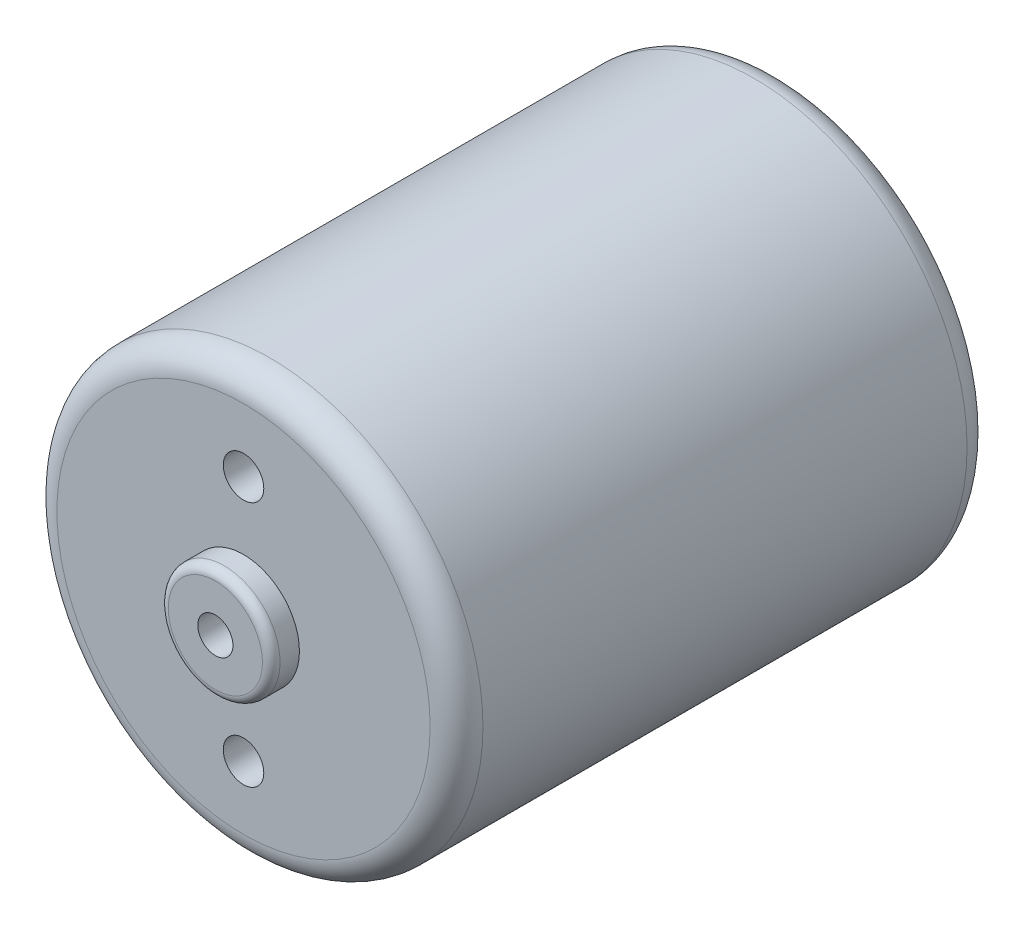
SolidWorks part; units mm, degrees
ref_plane "Front Plane" through (0, 0, 0) normal (0, 0, 1) x (1, 0, 0)
ref_plane "Top Plane" through (0, 0, 0) normal (0, 1, 0) x (1, 0, 0)
ref_plane "Right Plane" through (0, 0, 0) normal (1, 0, 0) x (0, 0, -1)
sketch "Sketch1" plane through (0, 0, 0) normal (0, 0, 1) x (1, 0, 0)
  circle A0 centre (0, 0) radius 12.1
  dimension "D1" = 24.2
extrude "Boss-Extrude1" add sketch "Sketch1" along normal mid plane 30.5
fillet "Fillet1" radius 1.5 2 edges at (12.1, 0, -15.25) (12.1, 0, 15.25)
sketch "Sketch2" plane through (0, 0, 15.25) normal (0, 0, 1) x (1, 0, 0)
  circle A0 centre (0, 0) radius 3.175
  dimension "D1" = 6.35
extrude "Boss-Extrude2" add sketch "Sketch2" along normal blind 1.6
sketch "Sketch5" plane through (0, 0, -15.25) normal (0, 0, -1) x (-1, 0, 0)
  line L0 (3.75, 2) -> (3.75, -2)
  line L1 (-4.25, -0.8446) -> (-4.25, 6.6258) construction
  line L2 (-12.7566, 0) -> (12.7566, 0) construction
  line L3 (13.31, 0) -> (-13.31, 0) construction
  line L4 (0, 7.7658) -> (0, -6.5085) construction
  line L5 (0, 13.31) -> (0, -13.31) construction
  arc A0 (3.75, 2) -> (3.75, -2) centre (0, 0) ccw
  point P12 (0, 0)
  dimension "D1" = 8.5
  dimension "D2" = 8
extrude "Boss-Extrude3" add sketch "Sketch5" along normal blind 2
sketch "Sketch3" plane through (0, 0, 16.85) normal (0, 0, 1) x (1, 0, 0)
  circle A0 centre (0, 0) radius 1
  dimension "D1" = 2
extrude "Cut-Extrude1" cut sketch "Sketch3" against normal through all
sketch "Sketch4" plane through (0, 0, -15.25) normal (0, 0, -1) x (-1, 0, 0)
  line L1 (6.45, -6.45) -> (-6.45, -6.45) construction
  line L2 (6.45, -6.45) -> (6.45, 6.45) construction
  line L3 (6.45, 6.45) -> (-6.45, 6.45) construction
  line L4 (-6.45, -6.45) -> (-6.45, 6.45) construction
  line L5 (6.45, -6.45) -> (-6.45, 6.45) construction
  line L6 (6.45, 6.45) -> (-6.45, -6.45) construction
  circle A0 centre (-6.45, 0) radius 1
  circle A1 centre (6.45, 0) radius 1
  point P0 (0, 0)
  dimension "D2" = 2
  dimension "D1" = 12.9
extrude "Cut-Extrude2" cut sketch "Sketch4" against normal blind 10
sketch "Sketch6" plane through (0, 0, 15.25) normal (0, 0, 1) x (1, 0, 0)
  line L0 (0, -13.31) -> (0, 13.31) construction
  line L1 (-12.9437, 0) -> (13.2761, 0) construction
  line L2 (13.31, 0) -> (-13.31, 0) construction
  circle A0 centre (0, 7) radius 1.15
  circle A1 centre (0, -7) radius 1.15
  point P11 (0, 0)
  dimension "D2" = 2.3
  dimension "D1" = 14
extrude "Cut-Extrude3" cut sketch "Sketch6" against normal blind 5
fillet "Fillet2" radius 0.5 2 edges at (4.25, 0, -17.25) (3.175, 0, 16.85)
